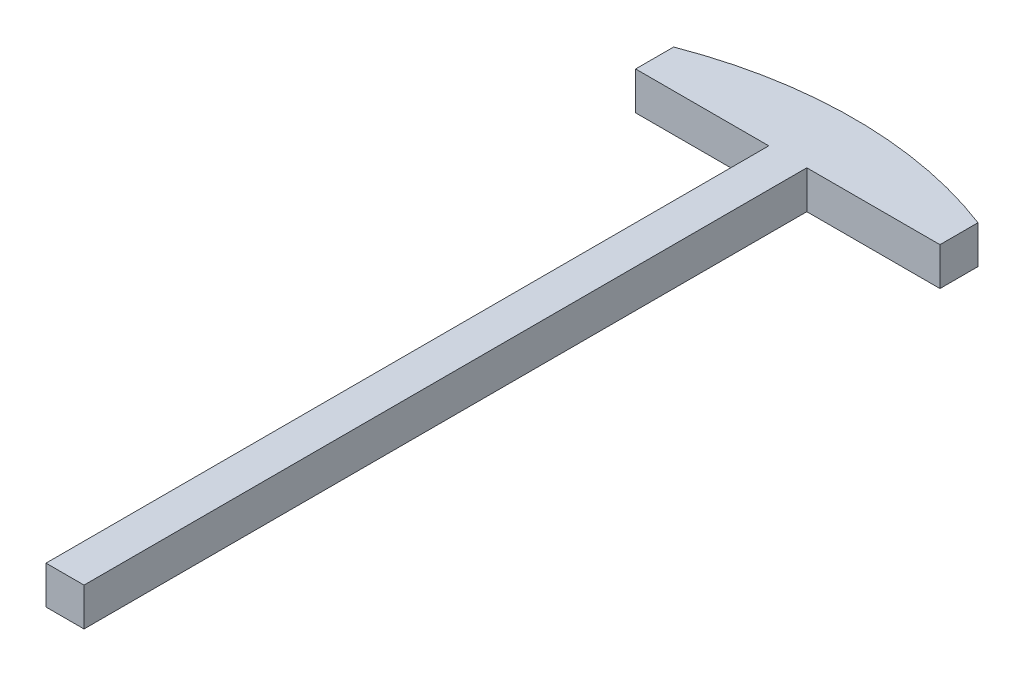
SolidWorks part; units mm, degrees
ref_plane "Front" through (0, 0, 0) normal (0, 0, 1) x (1, 0, 0)
ref_plane "Top" through (0, 0, 0) normal (0, 1, 0) x (1, 0, 0)
ref_plane "Right" through (0, 0, 0) normal (1, 0, 0) x (0, 0, -1)
sketch "Sketch1" plane through (0, 0, 0) normal (0, 1, 0) x (1, 0, 0)
  line L14 (2.3189, 6.1906) -> (19.8189, 6.1906)
  line L15 (19.8189, 6.1906) -> (19.8189, 11.1906)
  line L16 (-20.1811, 11.1906) -> (-20.1811, 6.1906)
  line L17 (-20.1811, 6.1906) -> (-2.6811, 6.1906)
  line L18 (-2.6811, 6.1906) -> (-2.6811, -88.8094)
  line L19 (-2.6811, -88.8094) -> (2.3189, -88.8094)
  line L20 (2.3189, -88.8094) -> (2.3189, 6.1906)
  arc A2 (19.8189, 11.1906) -> (-20.1811, 11.1906) centre (-0.1811, -40.9216) ccw
extrude "Boss-Extrude1" add sketch "Sketch1" along normal blind 5
